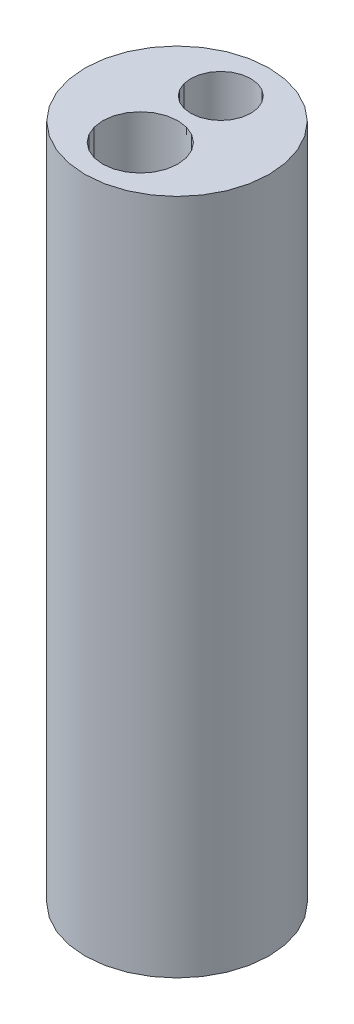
SolidWorks part; units mm, degrees
ref_plane "Front Plane" through (0, 0, 0) normal (0, 0, 1) x (1, 0, 0)
ref_plane "Top Plane" through (0, 0, 0) normal (0, 1, 0) x (1, 0, 0)
ref_plane "Right Plane" through (0, 0, 0) normal (1, 0, 0) x (0, 0, -1)
imported_body "RX Antenna Mount.stp"
sketch "Sketch1" plane through (0, 0, 0) normal (1, 0, 0) x (0, 0, -1)
  line L1 (-17.42, 55) -> (17.42, 55)
  line L2 (-17.42, 55) -> (-17.42, 45)
  line L3 (-17.42, 45) -> (17.42, 45)
  line L4 (17.42, 55) -> (17.42, 45)
  line L5 (-17.42, 55) -> (17.42, 45) construction
  line L6 (-17.42, 45) -> (17.42, 55) construction
  point P0 (0, 50)
  dimension "D1" = 10
extrude "Cut-Extrude1" cut sketch "Sketch1" against normal through all both and the other way through all
